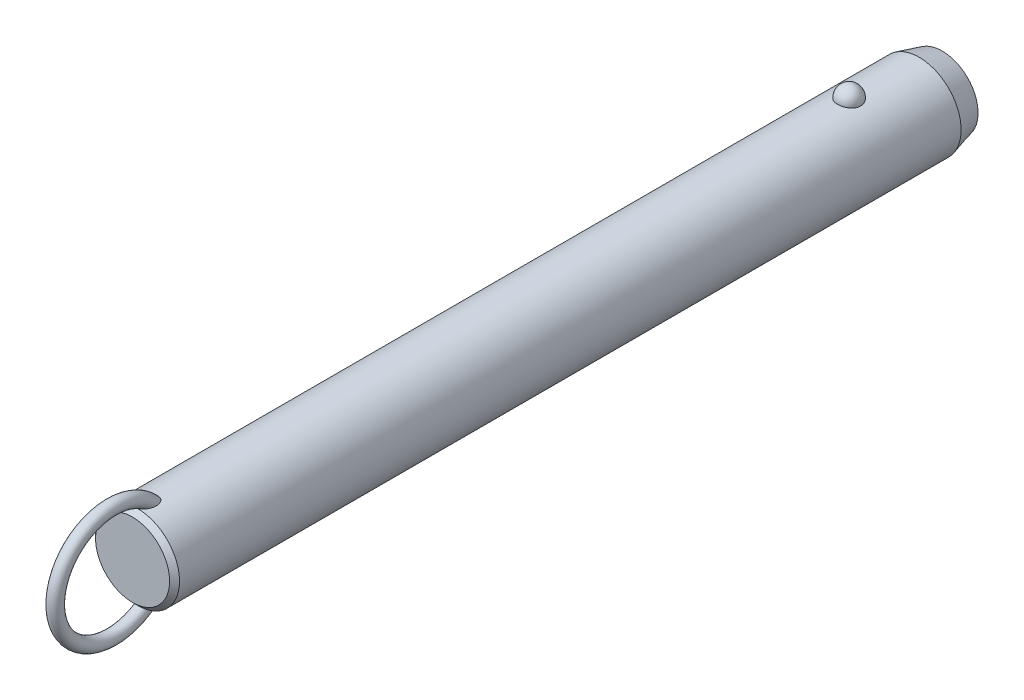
SolidWorks part; units mm, degrees
ref_plane "Front Plane" through (0, 0, 0) normal (0, 0, 1) x (1, 0, 0)
ref_plane "Top Plane" through (0, 0, 0) normal (0, 1, 0) x (1, 0, 0)
ref_plane "Right Plane" through (0, 0, 0) normal (1, 0, 0) x (0, 0, -1)
sketch "Sketch2" plane through (0, 0, 0) normal (0, 0, 1) x (1, 0, 0)
  circle A0 centre (0, 0) radius 12.7
  point P3 (0, 12.7)
  dimension "D1" = 25.4
extrude "Boss-Extrude1" add sketch "Sketch2" along normal blind 200.6
sketch "Sketch3" plane through (0, 0, 0) normal (0, 0, -1) x (-1, 0, 0)
  circle A0 centre (0, 0) radius 12.7
  dimension "D1" = 25.4
extrude "Boss-Extrude2" add sketch "Sketch3" along normal blind 31.7
chamfer "Chamfer1" distance 7 angle 15 1 edges at (-12.7, 0, -31.7)
sketch "Sketch12" plane through (0, 0, 0) normal (1, 0, 0) x (0, 0, -1)
  line L0 (-200.6, 12.7) -> (-200.6, -12.7) construction
  point P0 (-200.6, 0)
sketch "Sketch13" plane through (0, 0, 0) normal (1, 0, 0) x (0, 0, -1)
  circle A0 centre (-219.65, 0) radius 19.05
  point P2 (-200.6, 0)
  dimension "D1" = 38.1
sketch "Sketch14" plane through (0, 0, 0) normal (0, 1, 0) x (1, 0, 0)
  circle A0 centre (0, -202.6) radius 2
  point P2 (0, -200.6)
  dimension "D1" = 4
sweep "Sweep1" add profiles "Sketch14" path "Sketch13"
sketch "Sketch15" plane through (0, 0, 200.6) normal (0, 0, 1) x (1, 0, 0)
  circle A0 centre (0, 0) radius 12.7
  dimension "D1" = 25.4
extrude "Boss-Extrude3" add sketch "Sketch15" along normal blind 12.7
chamfer "Chamfer2" distance 1.5 angle 45 1 edges at (12.7, 0, 213.3)
sketch "Sketch18" plane through (0, 0, 0) normal (1, 0, 0) x (0, 0, -1)
  line L0 (24.7, 12.7) -> (-205.451, 12.7) construction
  line L1 (3.5, 16.2) -> (3.5, 9.2)
  line L2 (-205.451, -12.7) -> (24.7, -12.7) construction
  arc A0 (3.5, 16.2) -> (3.5, 9.2) centre (3.5, 12.7) ccw
  point P4 (0, 12.7)
  dimension "D1" = 28.9
revolve "Revolve1" add sketch "Sketch18" angle 360 about L1
